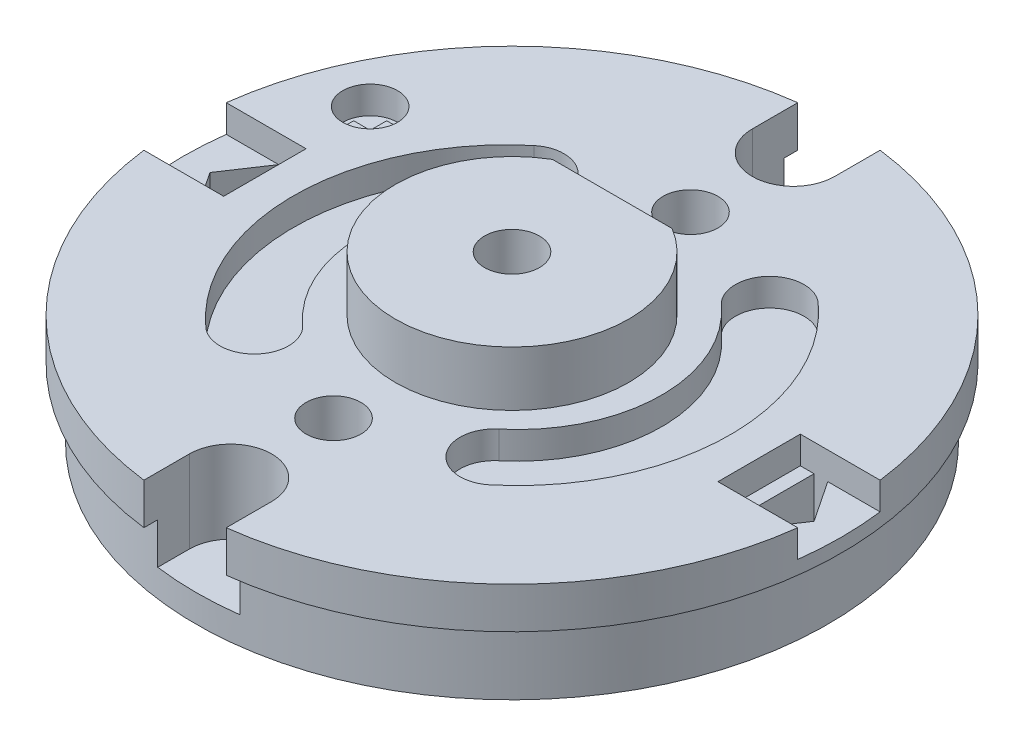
SolidWorks part; units mm, degrees
ref_plane "Plan de face" through (0, 0, 0) normal (0, 0, 1) x (1, 0, 0)
ref_plane "Plan de dessus" through (0, 0, 0) normal (0, 1, 0) x (1, 0, 0)
ref_plane "Plan de droite" through (0, 0, 0) normal (1, 0, 0) x (0, 0, -1)
sketch "Esquisse1" plane through (0, 0, 0) normal (0, 0, 1) x (1, 0, 0)
  line L0 (0, 0) -> (0, 19.6756) construction
  line L1 (-8.5, 0) -> (-8.5, 2.5)
  line L2 (-8.5, 2.5) -> (-1, 2.5)
  line L3 (-1, 2.5) -> (-1, 6)
  line L4 (-1, 6) -> (-4.25, 6)
  line L5 (-4.25, 6) -> (-4.25, 4)
  line L6 (-4.25, 4) -> (-12, 4)
  line L7 (-12, 4) -> (-12, 2.5)
  line L8 (-12, 2.5) -> (-11.5, 2.5)
  line L9 (-11.5, 2.5) -> (-11.5, 0)
  line L11 (-8.5, 0) -> (-11.5, 0)
  dimension "D1" = 2
  dimension "D2" = 8.5
  dimension "D3" = 24
  dimension "D4" = 2
  dimension "D5" = 17
  dimension "D6" = 1.5
  dimension "D7" = 2.5
  dimension "D8" = 2.5
  dimension "D9" = 23
revolve "Révolution1" add sketch "Esquisse1" angle 360 about L0
sketch "Esquisse2" plane through (0, 0, 0) normal (0, 1, 0) x (1, 0, 0)
  circle A0 centre (0, 6.5) radius 1
  point P0 (0, 6.5)
  dimension "D2" = 2
  dimension "D1" = 6.5
extrude "Enlèv. mat.-Extru.2" cut sketch "Esquisse2" along normal through all
sketch "Esquisse6" plane through (0, 0, 0) normal (1, 0, 0) x (0, 0, -1)
  line L0 (3.65, 7.3902) -> (3.65, 4)
  line L1 (12, 4) -> (-12, 4) construction
  dimension "D1" = 3.65
extrude "Enlèv. de mat.-Extru.-Mince1" cut sketch "Esquisse6" against normal through all and the other way through all thin
sketch "Esquisse8" plane through (0, 4, 0) normal (0, 1, 0) x (1, 0, 0)
  line L0 (0, 0) -> (-9.7809, 17.2689) construction
  line L1 (0, 0) -> (-10, -17.3205) construction
  arc A0 (-4.9492, 5.7531) -> (-5.1877, -5.9635) centre (0.0028, -0.2084) ccw
  arc A1 (-3.3518, 3.83) -> (-3.5133, -4.107) centre (0.0028, -0.2084) ccw
  arc A2 (-4.9492, 5.7531) -> (-3.3518, 3.83) centre (-4.1505, 4.7916) cw
  arc A3 (-3.5133, -4.107) -> (-5.1877, -5.9635) centre (-4.3505, -5.0353) cw
  dimension "D1" = 2.5
extrude "Enlèv. mat.-Extru.6" cut sketch "Esquisse8" against normal blind 1
sketch "Esquisse9" plane through (0, 4, 0) normal (0, 1, 0) x (1, 0, 0)
  line L0 (-1.5, 10.25) -> (-1.5, 15)
  line L1 (-1.5, 15) -> (1.5, 15)
  line L2 (1.5, 15) -> (1.5, 10.25)
  arc A0 (1.5, 10.25) -> (-1.5, 10.25) centre (0, 10.25) cw
  dimension "D1" = 1.5
  dimension "D2" = 3
  dimension "D3" = 10.25
  dimension "D4" = 15
extrude "Enlèv. mat.-Extru.7" cut sketch "Esquisse9" against normal blind 3
sketch "Esquisse12" plane through (0, 4, 0) normal (0, 1, 0) x (1, 0, 0)
  line L0 (-11, 0) -> (-10, 1.5)
  line L1 (-10, 1.5) -> (-9.5, 1.5)
  line L2 (-9.5, 1.5) -> (-9.5, -1.5)
  line L3 (-9.5, -1.5) -> (-10, -1.5)
  line L4 (-10, -1.5) -> (-11, 0)
  dimension "D1" = 1.5
  dimension "D2" = 3
  dimension "D3" = 1.5
  dimension "D4" = 9.5
  dimension "D5" = 1.5
  dimension "D6" = 0.5
  dimension "D7" = 0.5
extrude "Enlèv. mat.-Extru.8" cut sketch "Esquisse12" against normal through all
sketch "Esquisse13" plane through (0, 4, 0) normal (0, 1, 0) x (1, 0, 0)
  line L1 (-14.4735, 1.5) -> (-9, 1.5)
  line L2 (-14.4735, 1.5) -> (-14.4735, -1.5)
  line L3 (-14.4735, -1.5) -> (-9, -1.5)
  line L4 (-9, 1.5) -> (-9, -1.5)
  dimension "D1" = 3
  dimension "D2" = 1.5
  dimension "D3" = 9
  dimension "D4" = 5.4735
extrude "Enlèv. mat.-Extru.9" cut sketch "Esquisse13" against normal blind 1
sketch "Esquisse14" plane through (0, 4, 0) normal (0, 1, 0) x (1, 0, 0)
  circle A0 centre (-9.1652, 4) radius 1
  point P0 (-9.1652, 4)
  dimension "D1" = 4
  dimension "D2" = 10
extrude "Enlèv. mat.-Extru.10" cut sketch "Esquisse14" against normal blind 1
pattern_circular "Répétition circulaire2" count 2 every 180 about axis through (0, 0, 0) along (0, 1, 0) of "Enlèv. mat.-Extru.9", "Enlèv. mat.-Extru.8", "Enlèv. mat.-Extru.7", "Enlèv. mat.-Extru.6", "Enlèv. mat.-Extru.2"
sketch "Esquisse15" plane through (0, 3, 0) normal (0, 1, 0) x (1, 0, 0)
  line L0 (-9.9152, 4) -> (-8.4152, 4) construction
  line L1 (-9.9152, 4.15) -> (-8.4152, 4.15) construction
  line L2 (-9.9152, 4.15) -> (-9.9152, 3.85) construction
  line L3 (-9.9152, 3.85) -> (-8.4152, 3.85) construction
  line L4 (-8.4152, 4.15) -> (-8.4152, 3.85) construction
  line L5 (-9.3142, 4.751) -> (-9.3142, 3.251) construction
  line L6 (-9.0142, 4.751) -> (-9.3142, 4.751) construction
  line L7 (-9.0142, 4.751) -> (-9.0142, 3.251) construction
  line L8 (-9.0142, 3.251) -> (-9.3142, 3.251) construction
  line L9 (-9.9152, 4.15) -> (-9.3142, 4.15)
  line L10 (-9.3142, 4.15) -> (-9.3142, 4.751)
  line L11 (-9.3142, 4.751) -> (-9.0142, 4.751)
  line L12 (-9.0142, 4.751) -> (-9.0142, 4.15)
  line L13 (-9.0142, 4.15) -> (-8.4152, 4.15)
  line L14 (-8.4152, 4.15) -> (-8.4152, 3.85)
  line L15 (-8.4152, 3.85) -> (-9.0142, 3.85)
  line L16 (-9.0142, 3.85) -> (-9.0142, 3.251)
  line L17 (-9.0142, 3.251) -> (-9.3142, 3.251)
  line L18 (-9.3142, 3.251) -> (-9.3142, 3.85)
  line L19 (-9.3142, 3.85) -> (-9.9152, 3.85)
  line L20 (-9.9152, 3.85) -> (-9.9152, 4.15)
  point P6 (-9.1652, 4)
  dimension "D1" = 0.3
  dimension "D2" = 1.5
extrude "Extrusion1" add sketch "Esquisse15" along normal blind 0.1
